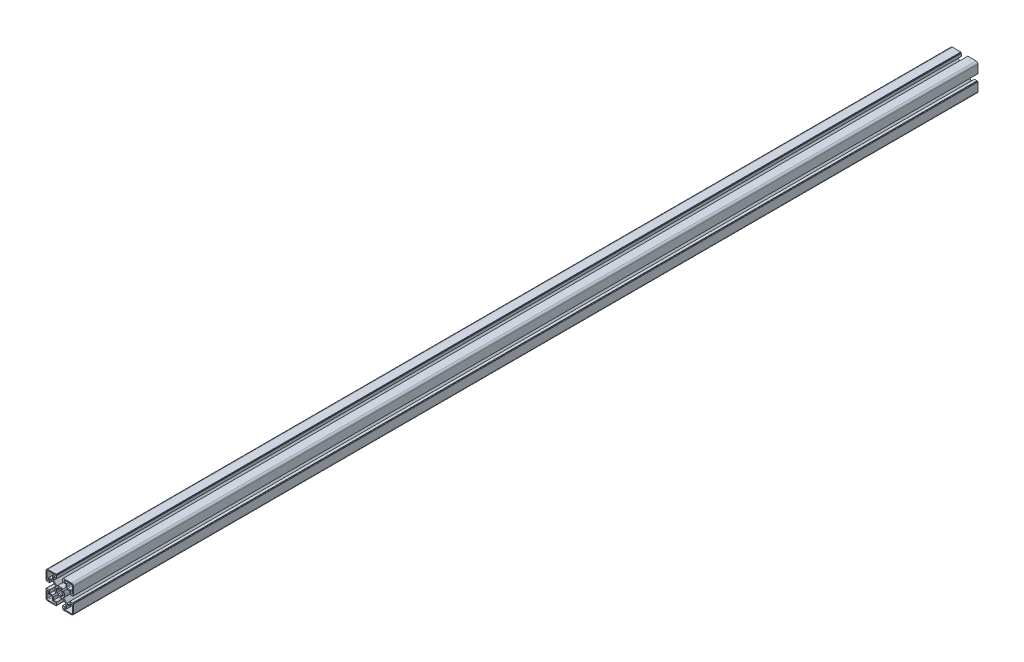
SolidWorks part; units mm, degrees
ref_plane "Front Plane" through (0, 0, 0) normal (0, 0, 1) x (1, 0, 0)
ref_plane "Top Plane" through (0, 0, 0) normal (0, 1, 0) x (1, 0, 0)
ref_plane "Right Plane" through (0, 0, 0) normal (1, 0, 0) x (0, 0, -1)
sketch "Sketch1" plane through (0, 0, 0) normal (0, 0, 1) x (1, 0, 0)
  line L2 (-19.5072, 22.5044) -> (-5.7912, 22.5044)
  line L3 (-5.7912, 22.5044) -> (-5.7912, 21.0058)
  line L4 (-5.7912, 21.0058) -> (-5.0038, 21.0058)
  line L6 (-5.0038, 21.0058) -> (-5.0038, 16.51)
  line L7 (-5.0038, 16.51) -> (-10.0457, 16.51)
  line L8 (-10.0457, 16.51) -> (-10.0457, 11.6801)
  line L9 (-10.0457, 11.6801) -> (-4.781, 6.4154)
  line L11 (-11.6801, 10.0457) -> (-6.4154, 4.781)
  line L12 (-16.51, 10.0457) -> (-11.6801, 10.0457)
  line L13 (-16.51, 5.0038) -> (-16.51, 10.0457)
  line L14 (-21.0058, 5.0038) -> (-16.51, 5.0038)
  line L15 (-21.0058, 5.7912) -> (-21.0058, 5.0038)
  line L16 (-22.5044, 5.7912) -> (-21.0058, 5.7912)
  line L17 (-22.5044, 19.5072) -> (-22.5044, 5.7912)
  line L18 (-18.0086, 11.5443) -> (-13.0429, 11.5443)
  line L19 (-18.0086, 11.5443) -> (-18.0086, 8.7884)
  line L20 (-11.5443, 18.0086) -> (-11.5443, 13.0429)
  line L21 (-21.0058, 19.5072) -> (-21.0058, 8.7884)
  line L23 (-11.5443, 18.0086) -> (-8.7884, 18.0086)
  line L24 (-19.5072, 21.0058) -> (-8.7884, 21.0058)
  line L25 (1.1893, 5.9789) -> (0.9762, 4.9077)
  line L26 (-1.1893, 5.9789) -> (-0.9762, 4.9077)
  line L27 (5.0686, 3.3868) -> (4.1605, 2.78)
  line L28 (3.3868, 5.0686) -> (2.78, 4.1605)
  line L29 (5.9789, -1.1893) -> (4.9077, -0.9762)
  line L30 (5.9789, 1.1893) -> (4.9077, 0.9762)
  line L31 (3.3868, -5.0686) -> (2.78, -4.1605)
  line L32 (5.0686, -3.3868) -> (4.1605, -2.78)
  line L33 (-1.1893, -5.9789) -> (-0.9762, -4.9077)
  line L34 (1.1893, -5.9789) -> (0.9762, -4.9077)
  line L35 (-5.0686, -3.3868) -> (-4.1605, -2.78)
  line L36 (-3.3868, -5.0686) -> (-2.78, -4.1605)
  line L37 (-5.9789, 1.1893) -> (-4.9077, 0.9762)
  line L38 (-5.9789, -1.1893) -> (-4.9077, -0.9762)
  line L39 (-3.3868, 5.0686) -> (-2.78, 4.1605)
  line L40 (-5.0686, 3.3868) -> (-4.1605, 2.78)
  line L41 (11.5443, 18.0086) -> (8.7884, 18.0086)
  line L42 (19.5072, 21.0058) -> (8.7884, 21.0058)
  line L43 (19.5072, 22.5044) -> (5.7912, 22.5044)
  line L44 (5.7912, 22.5044) -> (5.7912, 21.0058)
  line L45 (5.7912, 21.0058) -> (5.0038, 21.0058)
  line L46 (5.0038, 21.0058) -> (5.0038, 16.51)
  line L47 (5.0038, 16.51) -> (10.0457, 16.51)
  line L48 (10.0457, 16.51) -> (10.0457, 11.6801)
  line L49 (10.0457, 11.6801) -> (4.781, 6.4154)
  line L50 (11.6801, 10.0457) -> (6.4154, 4.781)
  line L51 (21.0058, 19.5072) -> (21.0058, 8.7884)
  line L52 (11.5443, 18.0086) -> (11.5443, 13.0429)
  line L53 (18.0086, 11.5443) -> (18.0086, 8.7884)
  line L54 (18.0086, 11.5443) -> (13.0429, 11.5443)
  line L55 (22.5044, 19.5072) -> (22.5044, 5.7912)
  line L56 (22.5044, 5.7912) -> (21.0058, 5.7912)
  line L57 (21.0058, 5.7912) -> (21.0058, 5.0038)
  line L58 (21.0058, 5.0038) -> (16.51, 5.0038)
  line L59 (16.51, 5.0038) -> (16.51, 10.0457)
  line L60 (16.51, 10.0457) -> (11.6801, 10.0457)
  line L61 (16.51, -10.0457) -> (11.6801, -10.0457)
  line L62 (16.51, -5.0038) -> (16.51, -10.0457)
  line L63 (21.0058, -5.0038) -> (16.51, -5.0038)
  line L64 (21.0058, -5.7912) -> (21.0058, -5.0038)
  line L65 (22.5044, -5.7912) -> (21.0058, -5.7912)
  line L66 (22.5044, -19.5072) -> (22.5044, -5.7912)
  line L67 (18.0086, -11.5443) -> (13.0429, -11.5443)
  line L68 (18.0086, -11.5443) -> (18.0086, -8.7884)
  line L69 (11.5443, -18.0086) -> (11.5443, -13.0429)
  line L70 (21.0058, -19.5072) -> (21.0058, -8.7884)
  line L71 (11.6801, -10.0457) -> (6.4154, -4.781)
  line L72 (10.0457, -11.6801) -> (4.781, -6.4154)
  line L73 (10.0457, -16.51) -> (10.0457, -11.6801)
  line L74 (5.0038, -16.51) -> (10.0457, -16.51)
  line L75 (5.0038, -21.0058) -> (5.0038, -16.51)
  line L76 (5.7912, -21.0058) -> (5.0038, -21.0058)
  line L77 (5.7912, -22.5044) -> (5.7912, -21.0058)
  line L78 (19.5072, -22.5044) -> (5.7912, -22.5044)
  line L79 (19.5072, -21.0058) -> (8.7884, -21.0058)
  line L80 (11.5443, -18.0086) -> (8.7884, -18.0086)
  line L81 (-11.5443, -18.0086) -> (-8.7884, -18.0086)
  line L82 (-19.5072, -21.0058) -> (-8.7884, -21.0058)
  line L83 (-19.5072, -22.5044) -> (-5.7912, -22.5044)
  line L84 (-5.7912, -22.5044) -> (-5.7912, -21.0058)
  line L85 (-5.7912, -21.0058) -> (-5.0038, -21.0058)
  line L86 (-5.0038, -21.0058) -> (-5.0038, -16.51)
  line L87 (-5.0038, -16.51) -> (-10.0457, -16.51)
  line L88 (-10.0457, -16.51) -> (-10.0457, -11.6801)
  line L89 (-10.0457, -11.6801) -> (-4.781, -6.4154)
  line L90 (-11.6801, -10.0457) -> (-6.4154, -4.781)
  line L91 (-21.0058, -19.5072) -> (-21.0058, -8.7884)
  line L92 (-11.5443, -18.0086) -> (-11.5443, -13.0429)
  line L93 (-18.0086, -11.5443) -> (-18.0086, -8.7884)
  line L94 (-18.0086, -11.5443) -> (-13.0429, -11.5443)
  line L95 (-22.5044, -19.5072) -> (-22.5044, -5.7912)
  line L96 (-22.5044, -5.7912) -> (-21.0058, -5.7912)
  line L97 (-21.0058, -5.7912) -> (-21.0058, -5.0038)
  line L98 (-21.0058, -5.0038) -> (-16.51, -5.0038)
  line L99 (-16.51, -5.0038) -> (-16.51, -10.0457)
  line L100 (-16.51, -10.0457) -> (-11.6801, -10.0457)
  arc A0 (-22.5044, 19.5072) -> (-19.5072, 22.5044) centre (-19.5072, 19.5072) cw
  arc A1 (-21.0058, 8.7884) -> (-18.0086, 8.7884) centre (-19.5072, 8.7884) ccw
  arc A2 (-21.0058, 19.5072) -> (-19.5072, 21.0058) centre (-19.5072, 19.5072) cw
  arc A3 (-8.7884, 21.0058) -> (-8.7884, 18.0086) centre (-8.7884, 19.5072) cw
  arc A4 (-11.5443, 13.0429) -> (-13.0429, 11.5443) centre (-13.0429, 13.0429) cw
  arc A5 (6.4154, -4.781) -> (6.4154, 4.781) centre (0, 0) ccw
  arc A6 (0.9762, 4.9077) -> (-0.9762, 4.9077) centre (0, 0) ccw
  arc A7 (-5.0686, 3.3868) -> (-5.9789, 1.1893) centre (0, 0) ccw
  arc A8 (4.1605, 2.78) -> (2.78, 4.1605) centre (0, 0) ccw
  arc A9 (4.9077, -0.9762) -> (4.9077, 0.9762) centre (0, 0) ccw
  arc A10 (2.78, -4.1605) -> (4.1605, -2.78) centre (0, 0) ccw
  arc A11 (-0.9762, -4.9077) -> (0.9762, -4.9077) centre (0, 0) ccw
  arc A12 (-4.1605, -2.78) -> (-2.78, -4.1605) centre (0, 0) ccw
  arc A13 (-4.9077, 0.9762) -> (-4.9077, -0.9762) centre (0, 0) ccw
  arc A14 (-2.78, 4.1605) -> (-4.1605, 2.78) centre (0, 0) ccw
  arc A15 (-5.9789, -1.1893) -> (-5.0686, -3.3868) centre (0, 0) ccw
  arc A16 (-3.3868, -5.0686) -> (-1.1893, -5.9789) centre (0, 0) ccw
  arc A17 (1.1893, -5.9789) -> (3.3868, -5.0686) centre (0, 0) ccw
  arc A18 (5.0686, -3.3868) -> (5.9789, -1.1893) centre (0, 0) ccw
  arc A19 (5.9789, 1.1893) -> (5.0686, 3.3868) centre (0, 0) ccw
  arc A20 (3.3868, 5.0686) -> (1.1893, 5.9789) centre (0, 0) ccw
  arc A21 (-1.1893, 5.9789) -> (-3.3868, 5.0686) centre (0, 0) ccw
  arc A22 (8.7884, 21.0058) -> (8.7884, 18.0086) centre (8.7884, 19.5072) ccw
  arc A23 (21.0058, 19.5072) -> (19.5072, 21.0058) centre (19.5072, 19.5072) ccw
  arc A24 (22.5044, 19.5072) -> (19.5072, 22.5044) centre (19.5072, 19.5072) ccw
  arc A25 (11.5443, 13.0429) -> (13.0429, 11.5443) centre (13.0429, 13.0429) ccw
  arc A26 (21.0058, 8.7884) -> (18.0086, 8.7884) centre (19.5072, 8.7884) cw
  arc A27 (21.0058, -8.7884) -> (18.0086, -8.7884) centre (19.5072, -8.7884) ccw
  arc A28 (11.5443, -13.0429) -> (13.0429, -11.5443) centre (13.0429, -13.0429) cw
  arc A29 (22.5044, -19.5072) -> (19.5072, -22.5044) centre (19.5072, -19.5072) cw
  arc A30 (21.0058, -19.5072) -> (19.5072, -21.0058) centre (19.5072, -19.5072) cw
  arc A31 (8.7884, -21.0058) -> (8.7884, -18.0086) centre (8.7884, -19.5072) cw
  arc A32 (-8.7884, -21.0058) -> (-8.7884, -18.0086) centre (-8.7884, -19.5072) ccw
  arc A33 (-21.0058, -19.5072) -> (-19.5072, -21.0058) centre (-19.5072, -19.5072) ccw
  arc A34 (-22.5044, -19.5072) -> (-19.5072, -22.5044) centre (-19.5072, -19.5072) ccw
  arc A35 (-11.5443, -13.0429) -> (-13.0429, -11.5443) centre (-13.0429, -13.0429) ccw
  arc A36 (-21.0058, -8.7884) -> (-18.0086, -8.7884) centre (-19.5072, -8.7884) cw
  arc A37 (4.781, 6.4154) -> (-4.781, 6.4154) centre (0, 0) ccw
  arc A38 (-4.781, -6.4154) -> (4.781, -6.4154) centre (0, 0) ccw
  arc A39 (-6.4154, 4.781) -> (-6.4154, -4.781) centre (0, 0) ccw
extrude "Boss-Extrude1" add sketch "Sketch1" against normal up to surface (1485.7984 mm away)
